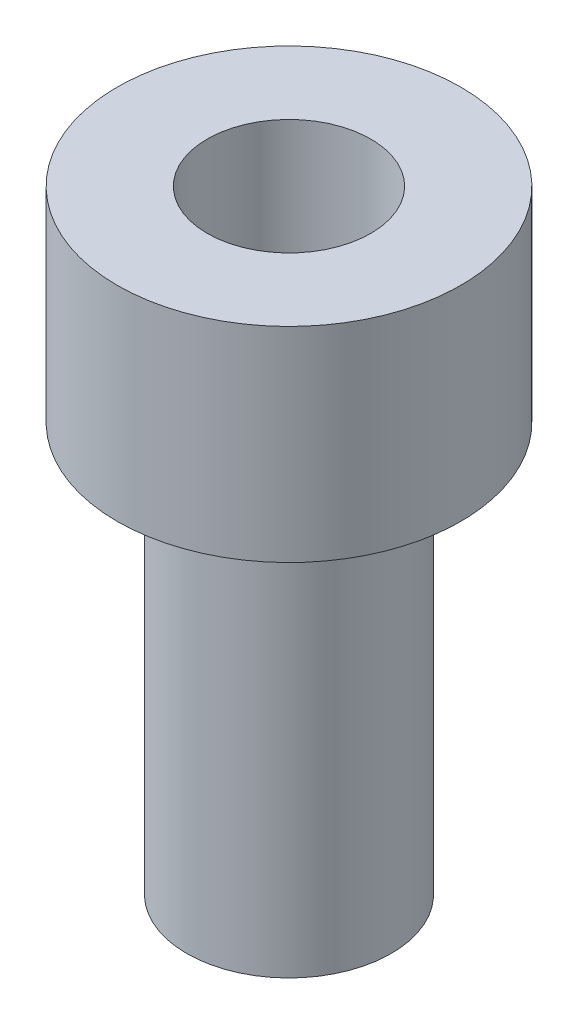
SolidWorks part; units mm, degrees
ref_plane "Front" through (0, 0, 0) normal (0, 0, 1) x (1, 0, 0)
ref_plane "Top" through (0, 0, 0) normal (0, 1, 0) x (1, 0, 0)
ref_plane "Right" through (0, 0, 0) normal (1, 0, 0) x (0, 0, -1)
sketch "Sketch1" plane through (0, 0, 0) normal (0, 1, 0) x (1, 0, 0)
  circle A0 centre (0, 0) radius 3.175
  dimension "D1" = 6.35
extrude "Base-Extrude" add sketch "Sketch1" along normal blind 12.7
sketch "Sketch2" plane through (0, 12.7, 0) normal (0, 1, 0) x (-1, 0, 0)
  circle A0 centre (0, 0) radius 5.334
  dimension "D1" = 10.668
extrude "Boss-Extrude1" add sketch "Sketch2" along normal blind 6.35
sketch "Sketch3" plane through (0, 19.05, 0) normal (0, 1, 0) x (-1, 0, 0)
  circle A0 centre (0, 0) radius 2.54
  dimension "D1" = 5.08
extrude "Cut-Extrude1" cut sketch "Sketch3" against normal blind 5.08
